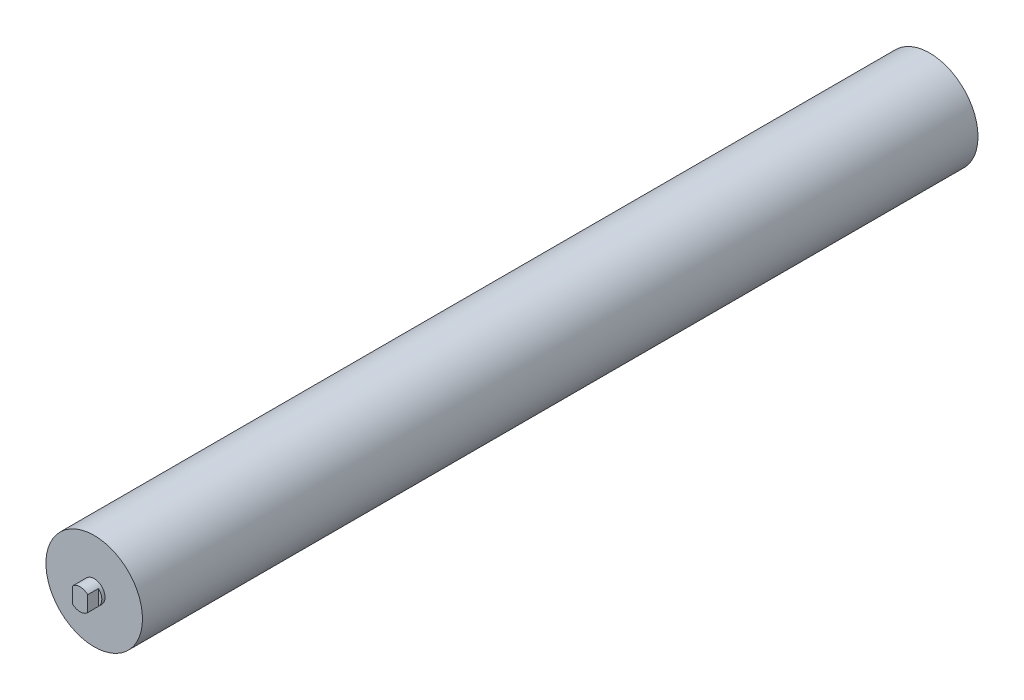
SolidWorks part; units mm, degrees
ref_plane "Front" through (0, 0, 0) normal (0, 0, 1) x (1, 0, 0)
ref_plane "Top" through (0, 0, 0) normal (0, 1, 0) x (1, 0, 0)
ref_plane "Right" through (0, 0, 0) normal (1, 0, 0) x (0, 0, -1)
sketch "Esquisse1" plane through (0, 0, 0) normal (0, 0, 1) x (1, 0, 0)
  circle A0 centre (0, 0) radius 44.5
  dimension "D2" = 89
extrude "Base-Extrusion" add sketch "Esquisse1" along normal blind 770
sketch "Esquisse2" plane through (0, 0, 770) normal (0, 0, 1) x (1, 0, 0)
  circle A0 centre (0, 0) radius 10
  dimension "D1" = 20
extrude "Boss.-Extru.1" add sketch "Esquisse2" along normal blind 13
sketch "Esquisse3" plane through (0, 0, 0) normal (0, 0, -1) x (-1, 0, 0)
  circle A0 centre (0, 0) radius 10
  dimension "D1" = 20
extrude "Boss.-Extru.2" add sketch "Esquisse3" along normal blind 13
sketch "Esquisse5" plane through (0, 0, -13) normal (0, 0, -1) x (-1, 0, 0)
  line L1 (-7, 20.2682) -> (7, 20.2682)
  line L2 (-7, 20.2682) -> (-7, -17.3308)
  line L3 (-7, -17.3308) -> (7, -17.3308)
  line L4 (7, 20.2682) -> (7, -17.3308)
  dimension "D1" = 14
  dimension "D2" = 7
extrude "Enlèv. mat.-Extru.1" cut sketch "Esquisse5" against normal blind 10 flip side to cut
sketch "Esquisse6" plane through (0, 0, 783) normal (0, 0, 1) x (1, 0, 0)
  line L1 (-7, 19.7787) -> (7, 19.7787)
  line L2 (-7, 19.7787) -> (-7, -20.0724)
  line L3 (-7, -20.0724) -> (7, -20.0724)
  line L4 (7, 19.7787) -> (7, -20.0724)
  dimension "D1" = 14
  dimension "D2" = 7
extrude "Enlèv. mat.-Extru.2" cut sketch "Esquisse6" against normal blind 10 flip side to cut
